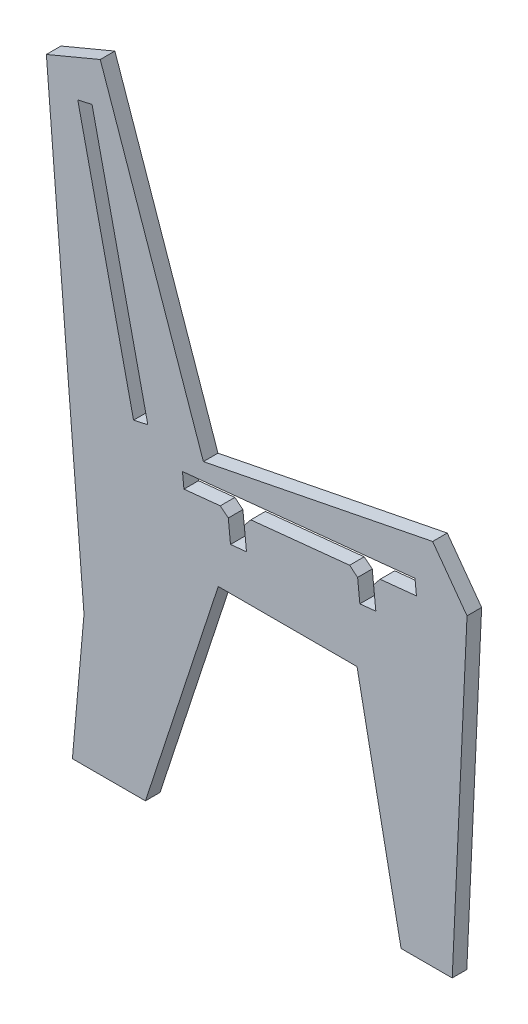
SolidWorks part; units mm, degrees
ref_plane "Plan de face" through (0, 0, 0) normal (0, 0, 1) x (1, 0, 0)
ref_plane "Plan de dessus" through (0, 0, 0) normal (0, 1, 0) x (1, 0, 0)
ref_plane "Plan de droite" through (0, 0, 0) normal (1, 0, 0) x (0, 0, -1)
sketch "Esquisse1" plane through (0, 0, 0) normal (0, 0, 1) x (1, 0, 0)
  line L0 (0, 0) -> (100, 0)
  line L1 (100, 0) -> (199.6875, 304.0763)
  line L2 (199.6875, 304.0763) -> (389.6875, 304.0763)
  line L3 (389.6875, 304.0763) -> (450, 0)
  line L4 (450, 0) -> (520, 0)
  line L5 (520, 0) -> (540.2924, 439.5318)
  line L6 (540.2924, 439.5318) -> (493.2057, 504.2067)
  line L7 (493.2057, 504.2067) -> (179.3205, 441.9487)
  line L8 (179.3205, 441.9487) -> (38.1508, 848.1151)
  line L9 (38.1508, 848.1151) -> (-35.6428, 817.2201)
  line L10 (-35.6428, 817.2201) -> (15.8848, 179.2977)
  line L11 (15.8848, 179.2977) -> (0, 0)
  line L12 (26.8716, 789.1876) -> (103.2414, 447.6211)
  line L13 (26.8716, 789.1876) -> (7.3535, 784.8236)
  line L14 (103.2414, 447.6211) -> (83.7233, 443.2571)
  line L15 (7.3535, 784.8236) -> (83.7233, 443.2571)
  line L16 (150.6772, 415.8778) -> (469.0167, 448.4349)
  line L17 (150.6772, 415.8778) -> (152.712, 395.9815)
  line L18 (469.0167, 448.4349) -> (471.0515, 428.5387)
  line L19 (152.712, 395.9815) -> (471.0515, 428.5387)
  dimension "D1" = 100
  dimension "D2" = 350
  dimension "D3" = 70
  dimension "D4" = 320
  dimension "D5" = 190
  dimension "D6" = 310
  dimension "D7" = 440
  dimension "D8" = 180
  dimension "D9" = 640
  dimension "D10" = 80
  dimension "D11" = 430
  dimension "D12" = 320
  dimension "D13" = 80
  dimension "D14" = 20
  dimension "D15" = 20
  dimension "D16" = 50
  dimension "D17" = 350
  dimension "D18" = 30
  dimension "D19" = 70
  dimension "D20" = 50
  dimension "D21" = 20
  dimension "D22" = 320
  dimension "D23" = 70
extrude "Boss.-Extru.1" add sketch "Esquisse1" along normal blind 20
sketch "Esquisse2" plane through (0, 0, 20) normal (0, 0, 1) x (1, 0, 0)
  line L0 (212.4007, 402.086) -> (234.2865, 404.3243)
  line L1 (212.4007, 402.086) -> (216.4703, 362.2936)
  line L2 (234.2865, 404.3243) -> (238.3562, 364.5319)
  line L3 (216.4703, 362.2936) -> (238.3562, 364.5319)
  line L4 (152.712, 395.9815) -> (471.0515, 428.5387) construction
  line L5 (389.477, 420.1959) -> (411.3629, 422.4342)
  line L6 (389.477, 420.1959) -> (393.5467, 380.4035)
  line L7 (411.3629, 422.4342) -> (415.4325, 382.6418)
  line L8 (393.5467, 380.4035) -> (415.4325, 382.6418)
  line L9 (150.6772, 415.8778) -> (152.712, 395.9815) construction
  line L10 (471.0515, 428.5387) -> (469.0167, 448.4349) construction
  dimension "D1" = 22
  dimension "D2" = 40
  dimension "D3" = 60
  dimension "D4" = 60
  dimension "D5" = 22
  dimension "D6" = 40
extrude "Enlèv. mat.-Extru.1" cut sketch "Esquisse2" against normal up to next
chamfer "Chanfrein1" distance 10 angle 45 4 edges at (389.477, 420.1959, 10) (411.3629, 422.4342, 10) (234.2865, 404.3243, 10) (212.4007, 402.086, 10)
